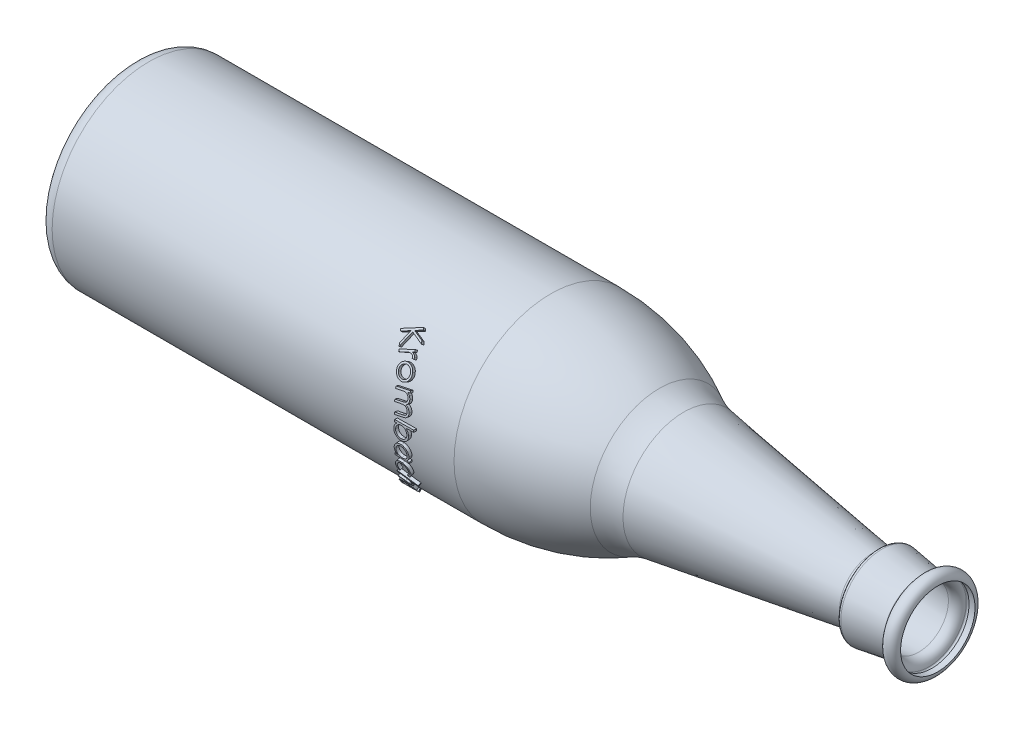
SolidWorks part; units mm, degrees
ref_plane "Vorne" through (0, 0, 0) normal (0, 0, 1) x (1, 0, 0)
ref_plane "Oben" through (0, 0, 0) normal (0, 1, 0) x (1, 0, 0)
ref_plane "Rechts" through (0, 0, 0) normal (1, 0, 0) x (0, 0, -1)
sketch "Skizze1" plane through (0, 0, 0) normal (0, 0, 1) x (1, 0, 0)
  line L0 (0, 0) -> (330.7642, 0) construction
  line L1 (2.5, 0) -> (2.5, 22.0858)
  line L2 (2.2071, 22.7929) -> (1.4645, 23.5355)
  line L3 (0, 27.0711) -> (0, 27.5)
  line L4 (5, 32.5) -> (140, 32.5)
  line L6 (184.6739, 20.416) -> (247.8031, 10.7936)
  line L7 (250.1045, 12.7707) -> (250.1045, 12.8458)
  line L8 (251.2509, 13.8351) -> (263.8833, 11.9656)
  line L9 (270, 12.5) -> (270, 0)
  line L10 (270, 0) -> (2.5, 0)
  line L11 (180, 21.1285) -> (180, 6.6042) construction
  arc A0 (270, 12.5) -> (265.0212, 12.8248) centre (267.5, 12.5) ccw
  arc A1 (0, 27.5) -> (5, 32.5) centre (5, 27.5) cw
  arc A2 (176.455, 23.1912) -> (140, 32.5) centre (140, -43.5369) ccw
  arc A3 (1.4645, 23.5355) -> (0, 27.0711) centre (5, 27.0711) cw
  arc A5 (247.8031, 10.7936) -> (250.1045, 12.7707) centre (248.1045, 12.7707) ccw
  arc A6 (250.1045, 12.8458) -> (251.2509, 13.8351) centre (251.1045, 12.8458) cw
  arc A7 (263.8833, 11.9656) -> (265.0212, 12.8248) centre (264.0297, 12.9548) ccw
  arc A8 (2.5, 22.0858) -> (2.2071, 22.7929) centre (1.5, 22.0858) ccw
  arc A9 (184.6739, 20.416) -> (176.455, 23.1912) centre (188.441, 45.1306) cw
  point P19 (0, 32.5)
  point P22 (0, 25)
  point P30 (250.1045, 14.0047)
  point P33 (265.1045, 11.7848)
  dimension "D3" = 2.5
  dimension "D6" = 25
  dimension "D11" = 5
  dimension "D12" = 25
  dimension "D13" = 2
  dimension "D14" = 1
  dimension "D1" = 65
  dimension "D2" = 270
  dimension "D4" = 140
  dimension "D5" = 15
  dimension "D7" = 40
  dimension "D8" = 2.5
  dimension "D9" = 50
  dimension "D10" = 135
revolve "Rotation1" add sketch "Skizze1" angle 360 about L0
shell "Wandung1" thickness 2
ref_plane "Ebene1" through (0, 0, 32.5) normal (0, 0, 1) x (1, 0, 0)
sketch "Skizze2" plane through (0, 0, 32.5) normal (0, 0, 1) x (1, 0, 0)
  line L0 (140, 32.5) -> (140, -32.5) construction
  line L1 (5, -32.5) -> (140, -32.5) construction
  line L2 (0, 27.0711) -> (0, -27.0711) construction
  line L3 (0, 27.5) -> (0, -27.5) construction
  spline S0 degree 2 poles (109, 32.5) (133, 0) (109, -32.5) knots 0 0 0 1 1 1
  point P6 (0, 0)
  point P12 (0, 0)
  point P13 (0, 0)
  dimension "D1" = 109
  dimension "D2" = 109
  dimension "D3" = 121
sketch "Skizze3"
wrap "Umwickeln1" sketch "Skizze3" wrap type emboss source sketch "Skizze3" thickness 1 parameters "D1"=1
